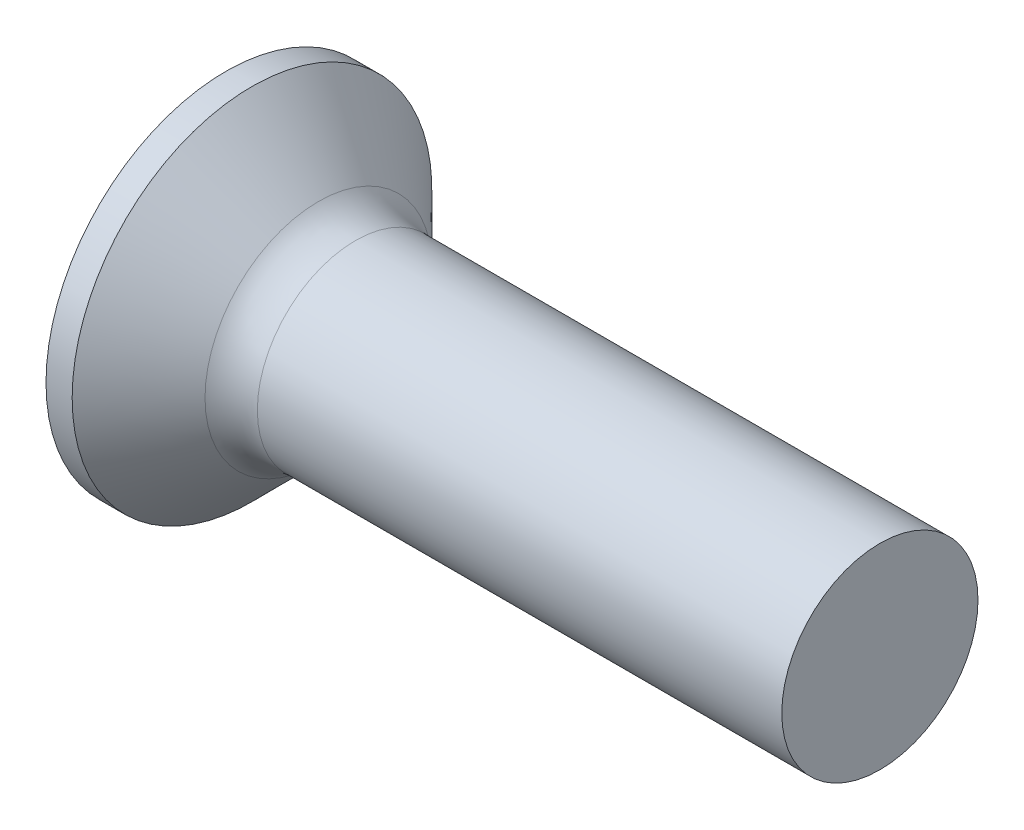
SolidWorks part; units mm, degrees
ref_plane "Plane1" through (0, 0, 0) normal (0, 0, 1) x (1, 0, 0)
ref_plane "Plane2" through (0, 0, 0) normal (0, 1, 0) x (1, 0, 0)
ref_plane "Plane3" through (0, 0, 0) normal (1, 0, 0) x (0, 0, -1)
sketch "BodySke" plane through (0, 0, 0) normal (0, 0, 1) x (1, 0, 0)
  line L0 (0, 0) -> (0, 2.75)
  line L1 (0, 2.75) -> (0.4, 2.75)
  line L2 (1.65, 1.5) -> (10, 1.5)
  line L3 (10, 1.5) -> (10, 0)
  line L4 (10, 0) -> (0, 0)
  line L5 (-6.35, 0) -> (82.55, 0) construction
  line L6 (1.65, -1.5) -> (10, -1.5) construction
  line L7 (0.4, -2.75) -> (1.65, -1.5) construction
  line L8 (0.4, 2.75) -> (1.65, 1.5)
  line L9 (0, -2.75) -> (0.4, -2.75) construction
  line L10 (2.15, 3.0875) -> (2.15, -6.4375) construction
  line L11 (0, 6.35) -> (0, -3.175) construction
  dimension "Diameter" = 3
  dimension "Length" = 10
  dimension "Head_ht" = 1.65
  dimension "Head_dia" = 5.5
  dimension "Head_ang" = 90
  dimension "D6" = 0.4
  dimension "Advance" = 0.5
  dimension "Thread_nom" = 10
revolve "Base-Revolve" add sketch "BodySke"
fillet "Fillet1" radius 0.8 1 edges at (1.65, 0, 1.5)
sketch "Sketch3" plane through (0, 0, 0) normal (-1, 0, 0) x (0, 0, 1)
  line L0 (-0.37, 1.5) -> (0.37, 1.5)
  line L1 (0.37, 1.5) -> (0.37, -1.5)
  line L2 (0.37, -1.5) -> (-0.37, -1.5)
  line L3 (-0.37, -1.5) -> (-0.37, 1.5)
  dimension "D1" = 1.5
  dimension "Cross_dia" = 3
  dimension "D2" = 0.37
  dimension "Cross_width" = 0.74
ref_plane "Plane4" through (2.01, 0, 0) normal (-1, 0, 0) x (0, 0, 1)
sketch "Sketch4" plane through (2.01, 0, 0) normal (-1, 0, 0) x (0, 0, 1)
  line L0 (-0.37, 0.4979) -> (0.37, 0.4979)
  line L3 (0.37, 0.4979) -> (0.37, -0.4979)
  line L4 (0.37, -0.4979) -> (-0.37, -0.4979)
  line L5 (-0.37, -0.4979) -> (-0.37, 0.4979)
  dimension "D1" = 0.74
  dimension "D2" = 0.9957
  dimension "D3" = 0.37
  dimension "D4" = 0.4979
loft "Recess" cut profiles "Sketch3", "Sketch4"
pattern_circular "RecPat" count 2 every 90 about axis through (0, 0, 0) along (1, 0, 0) of "Recess"
sketch "RecCorSke" plane through (0, 0, 0) normal (0, 0, 1) x (1, 0, 0)
  line L0 (-3.175, 0) -> (15.875, 0) construction
  line L2 (0, 0) -> (0, 0.6966)
  line L3 (0, 0.6966) -> (2.01, 0.556)
  line L4 (2.01, 0.556) -> (2.1907, 0)
  line L5 (2.1907, 0) -> (0, 0)
  dimension "Diameter" = 1.112
  dimension "Depth" = 2.01
  dimension "Draft_angle" = 4
  dimension "Bottom_angle" = 18
revolve "RecessCore" cut sketch "RecCorSke" angle 360 about L0
sketch "ThdSchSke" plane through (0, 0, 0) normal (0, 0, 1) x (1, 0, 0)
  line L0 (2.15, -1.2195) -> (1.9536, -1.5)
  line L1 (2.15, -1.2195) -> (2.3464, -1.5)
  line L2 (2.3464, -1.5) -> (2.3464, -1.875)
  line L3 (-3.175, 0) -> (5.1513, 0) construction
  line L5 (2.3464, -1.875) -> (1.9536, -1.875)
  line L6 (1.9536, -1.875) -> (1.9536, -1.5)
  line L7 (0, 2.75) -> (0, -2.75) construction
  dimension "Thread_minor" = 2.439
  dimension "Diameter" = 3
  dimension "Start" = 2.15
  dimension "SideAngle" = 55
  dimension "VeeAngle" = 70
  dimension "Overcut" = 3.75
revolve "ThreadSchematic" [suppressed] cut sketch "ThdSchSke" angle 360 about L3
pattern_linear "ThdSchPat" [suppressed]
equation "\"D1@Sketch3\" = \"Cross_dia@Sketch3\" / 2"
equation "\"D2@Sketch3\" = \"Cross_width@Sketch3\" / 2"
equation "\"Depth@RecCorSke\" = \"Cross_depth@Plane4\""
equation "\"D1@Sketch4\" = \"Cross_width@Sketch3\""
equation "\"D2@Sketch4\" = \"Cross_dia@Sketch3\" - 2.0 * \"Cross_depth@Plane4\" * tan(26.5  * 0.017453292)"
equation "\"D3@Sketch4\" = \"D1@Sketch4\" / 2"
equation "\"D4@Sketch4\" = \"D2@Sketch4\" / 2"
equation "\"Thread_length@ThreadCosmetic\" = ((sgn( (\"Length@BodySke\" - \"Advance@BodySke\" * 1.0 - \"Head_ht@BodySke\" ) - \"Thread_nom@BodySke\" )-1)*( (\"Length@BodySke\" - \"Advance@BodySke\" * 1.0 - \"Head_ht@BodySke\" "
equation "\"Thread_minor@ThdSchSke\" = \"Thread_minor@ThreadCosmetic\""
equation "\"Diameter@ThdSchSke\" = \"Diameter@BodySke\""
equation "\"Overcut@ThdSchSke\" = \"Diameter@BodySke\" * 1.25"
equation "\"Start@ThdSchSke\" = 0.000001 + \"Length@BodySke\" - \"Thread_length@ThreadCosmetic\"  '---Countersunk---"
equation "\"Num_threads@ThdSchPat\" = int( \"Thread_length@ThreadCosmetic\" / \"Advance@BodySke\" + 0.999 )  + 1"
equation "\"Advance@ThdSchPat\" = \"Thread_length@ThreadCosmetic\" /  (\"Num_threads@ThdSchPat\" - 1) 'relax it"
